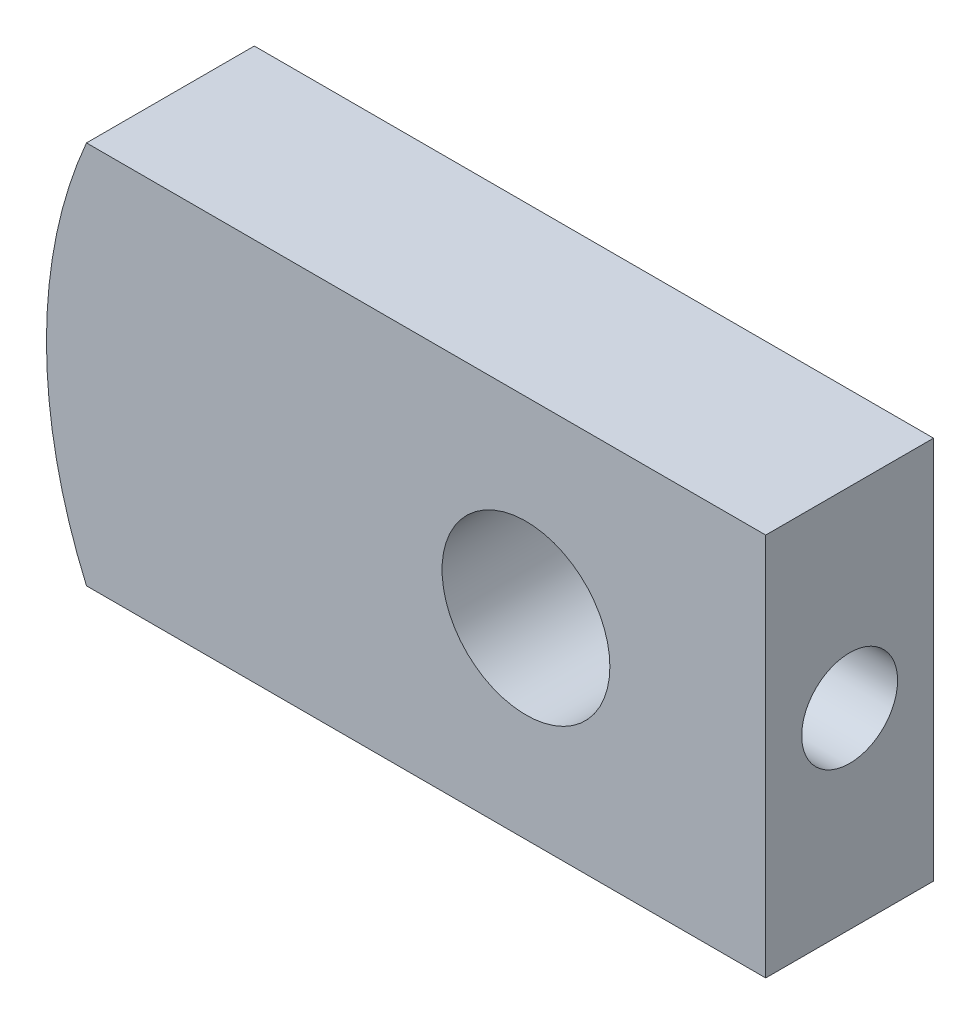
SolidWorks part; units mm, degrees
ref_plane "Face" through (0, 0, 0) normal (0, 0, 1) x (1, 0, 0)
ref_plane "Dessus" through (0, 0, 0) normal (0, 1, 0) x (1, 0, 0)
ref_plane "Droite" through (0, 0, 0) normal (1, 0, 0) x (0, 0, -1)
sketch "Esquisse1" plane through (0, 0, 0) normal (0, 0, 1) x (1, 0, 0)
  line L0 (0, 0) -> (50.1235, 0) construction
  line L1 (-18.3303, 8) -> (10, 8)
  line L2 (-18.3303, -8) -> (10, -8)
  line L3 (10, 8) -> (10, -8)
  arc A1 (-18.3303, 8) -> (-18.3303, -8) centre (0, 0) ccw
  dimension "D1" = 16
  dimension "D2" = 20
  dimension "D3" = 10
extrude "Base-Extrusion" add sketch "Esquisse1" along normal blind 7
sketch "Esquisse2" plane through (0, 0, 7) normal (0, 0, 1) x (1, 0, 0)
  circle A0 centre (0, 0) radius 3.5
  dimension "D1" = 7
extrude "Enlèv. mat.-Extru.1" cut sketch "Esquisse2" against normal through all
sketch "Esquisse3" plane through (10, 0, 0) normal (1, 0, 0) x (0, 0, -1)
  line L0 (-3.5, 8) -> (-3.5, -4.8123) construction
  line L1 (-7, 8) -> (0, 8) construction
  line L2 (-7, 0) -> (0, 0) construction
  circle A0 centre (-3.5, 0) radius 2
  dimension "D1" = 4
extrude "Enlèv. mat.-Extru.2" cut sketch "Esquisse3" against normal up to next
